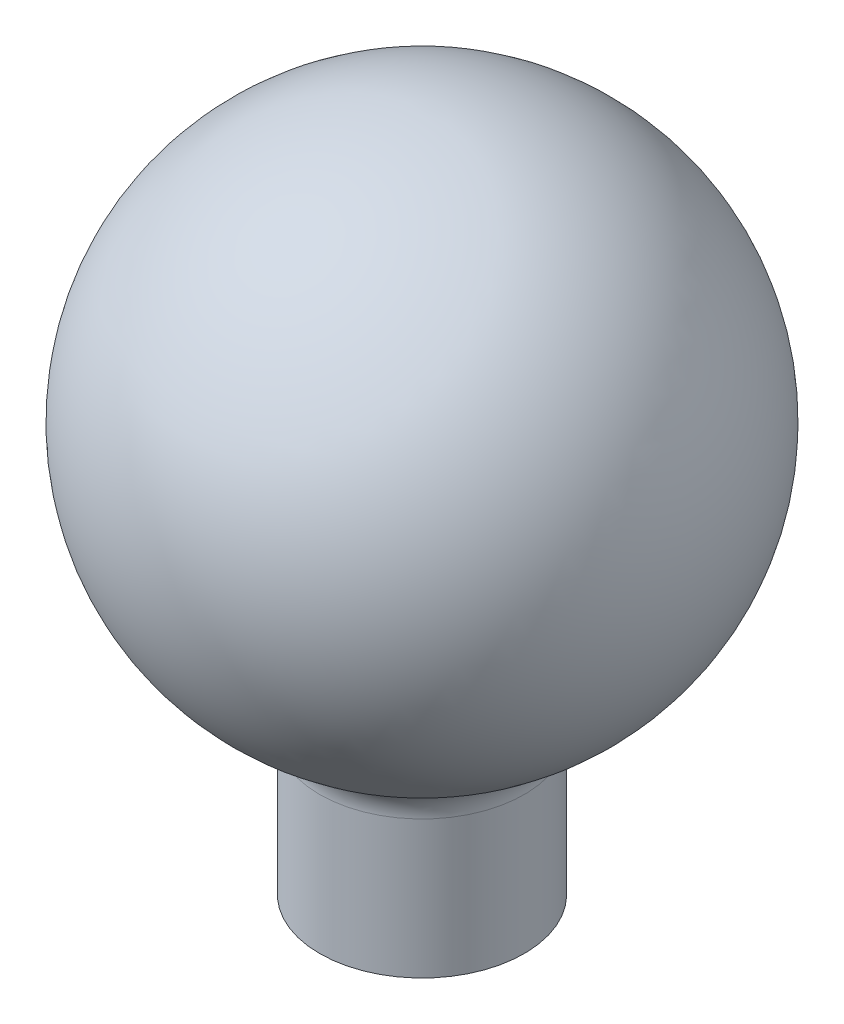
SolidWorks part; units mm, degrees
ref_plane "Front" through (0, 0, 0) normal (0, 0, 1) x (1, 0, 0)
ref_plane "Top" through (0, 0, 0) normal (0, 1, 0) x (1, 0, 0)
ref_plane "Right" through (0, 0, 0) normal (1, 0, 0) x (0, 0, -1)
sketch "Sketch1" plane through (0, 0, 0) normal (0, 1, 0) x (1, 0, 0)
  line L0 (4.5, 6) -> (4.5, -6)
  arc A0 (4.5, 6) -> (4.5, -6) centre (0, 0) ccw
  circle A1 centre (0, 0) radius 12.5
  dimension "D1" = 15
  dimension "D2" = 25
  dimension "D3" = 12
extrude "Extrude1" add sketch "Sketch1" along normal blind 20
sketch "Sketch3" plane through (0, 0, 0) normal (0, 0, 1) x (1, 0, 0)
  line L0 (12.5, 20) -> (-12.5, 20) construction
  line L1 (12.5, 20) -> (0, 20)
  line L2 (0, 20) -> (0, 82.5)
  arc A0 (12.5, 20) -> (0, 82.5) centre (0, 50) ccw
  dimension "D1" = 65
revolve "Revolve1" add sketch "Sketch3" angle 360 about L2
fillet "Fillet1" radius 5 1 edges at (0, 20, 12.5)
